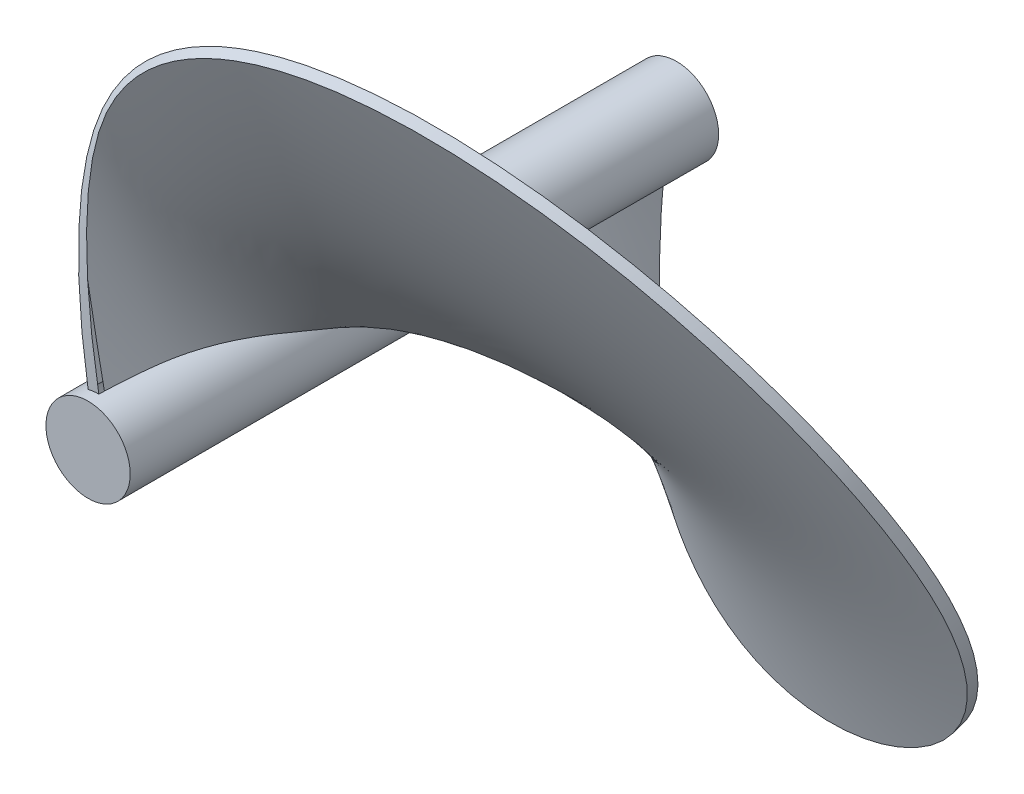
SolidWorks part; units mm, degrees
ref_plane "Ebene vorne" through (0, 0, 0) normal (0, 0, 1) x (1, 0, 0)
ref_plane "Ebene oben" through (0, 0, 0) normal (0, 1, 0) x (1, 0, 0)
ref_plane "Ebene rechts" through (0, 0, 0) normal (1, 0, 0) x (0, 0, -1)
sketch "Skizze1" plane through (0, 0, 0) normal (1, 0, 0) x (0, 0, -1)
  line L0 (0, 0) -> (100, 0) construction
  line L1 (0, 50) -> (0, 0) construction
  line L2 (100, 0) -> (100, -50) construction
  dimension "D1" = 100
  dimension "D2" = 50
  dimension "D3" = 50
sketch "Skizze2" plane through (0, 0, 0) normal (0, 1, 0) x (1, 0, 0)
  line L0 (0, 50) -> (100, 50) construction
  line L1 (0, 0) -> (0, 100) construction
  dimension "D1" = 100
sketch3d "3D-Skizze1"
  line L0 (0, 0, -50) -> (100, 0, -50) construction
  line L1 (0, 50, 0) -> (0, 0, 0) construction
  line L2 (0, 0, -100) -> (0, -50, -100) construction
  line L3 (0, 0, 0) -> (0, 0, -100)
  spline S0 degree 3 poles (0, 0, 0) (0, 0.0018, 0) (-20.4124, 111.9527, 5.5018) (185.5051, -0.0054, -50) (-20.4124, -111.9376, -105.5018) (0, -0.0141, -100) (0, 0, -100) knots 0 0 0 0 0.144949 0.5 0.855051 1 1 1 1
surface "Oberflächenausfüllung1" sketch "3D-Skizze1"
thicken "Wanddicke auftragen1" surfaces to thicken 101 thickness 1 thickness side both sides parameters "D1"=1
sketch "Skizze3" plane through (0, 0, 0) normal (0, 0, 1) x (1, 0, 0)
  circle A0 centre (0, 0) radius 7.5
  dimension "D1" = 15
extrude "Aufsatz-Linear austragen1" add sketch "Skizze3" along normal through all and the other way through all
